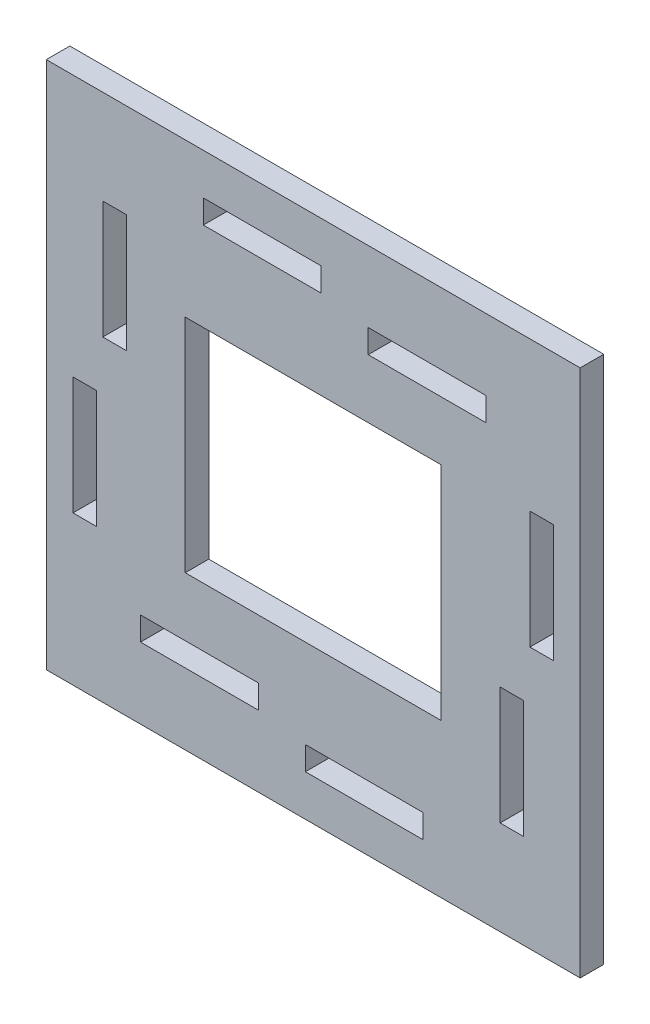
SolidWorks part; units mm, degrees
ref_plane "Alzado" through (0, 0, 0) normal (0, 0, 1) x (1, 0, 0)
ref_plane "Planta" through (0, 0, 0) normal (0, 1, 0) x (1, 0, 0)
ref_plane "Vista lateral" through (0, 0, 0) normal (1, 0, 0) x (0, 0, -1)
sketch "Sketch1" plane through (0, 0, 0) normal (0, 0, 1) x (1, 0, 0)
  line L1 (-34, -33.65) -> (34, -33.65)
  line L2 (-34, -33.65) -> (-34, 33.65)
  line L3 (-34, 33.65) -> (34, 33.65)
  line L4 (34, -33.65) -> (34, 33.65)
  line L5 (-34, -33.65) -> (34, 33.65) construction
  line L6 (-34, 33.65) -> (34, -33.65) construction
  line L7 (-16.3, -14.1) -> (16.3, -14.1)
  line L8 (-16.3, -14.1) -> (-16.3, 14.1)
  line L9 (-16.3, 14.1) -> (16.3, 14.1)
  line L10 (16.3, -14.1) -> (16.3, 14.1)
  line L11 (-16.3, -14.1) -> (16.3, 14.1) construction
  line L12 (-16.3, 14.1) -> (16.3, -14.1) construction
  line L13 (7, 21.6) -> (22, 21.6)
  line L14 (7, 21.6) -> (7, 24.6)
  line L15 (7, 24.6) -> (22, 24.6)
  line L16 (22, 21.6) -> (22, 24.6)
  line L17 (7, 21.6) -> (22, 24.6) construction
  line L18 (7, 24.6) -> (22, 21.6) construction
  line L19 (1, 25.4) -> (-14, 25.4)
  line L20 (1, 25.4) -> (1, 28.4)
  line L21 (1, 28.4) -> (-14, 28.4)
  line L22 (-14, 25.4) -> (-14, 28.4)
  line L23 (1, 25.4) -> (-14, 28.4) construction
  line L24 (1, 28.4) -> (-14, 25.4) construction
  line L25 (27.6, 14.65) -> (30.6, 14.65)
  line L26 (27.6, 14.65) -> (27.6, -0.35)
  line L27 (27.6, -0.35) -> (30.6, -0.35)
  line L28 (30.6, 14.65) -> (30.6, -0.35)
  line L29 (27.6, 14.65) -> (30.6, -0.35) construction
  line L30 (27.6, -0.35) -> (30.6, 14.65) construction
  line L31 (23.8, -6.65) -> (26.8, -6.65)
  line L32 (23.8, -6.65) -> (23.8, -21.65)
  line L33 (23.8, -21.65) -> (26.8, -21.65)
  line L34 (26.8, -6.65) -> (26.8, -21.65)
  line L35 (23.8, -6.65) -> (26.8, -21.65) construction
  line L36 (23.8, -21.65) -> (26.8, -6.65) construction
  line L37 (14, -25.4) -> (-1, -25.4)
  line L38 (14, -25.4) -> (14, -28.4)
  line L39 (14, -28.4) -> (-1, -28.4)
  line L40 (-1, -25.4) -> (-1, -28.4)
  line L41 (14, -25.4) -> (-1, -28.4) construction
  line L42 (14, -28.4) -> (-1, -25.4) construction
  line L43 (-7, -21.6) -> (-22, -21.6)
  line L44 (-7, -21.6) -> (-7, -24.6)
  line L45 (-7, -24.6) -> (-22, -24.6)
  line L46 (-22, -21.6) -> (-22, -24.6)
  line L47 (-7, -21.6) -> (-22, -24.6) construction
  line L48 (-7, -24.6) -> (-22, -21.6) construction
  line L49 (-30.6, 0.35) -> (-27.6, 0.35)
  line L50 (-30.6, 0.35) -> (-30.6, -14.65)
  line L51 (-30.6, -14.65) -> (-27.6, -14.65)
  line L52 (-27.6, 0.35) -> (-27.6, -14.65)
  line L53 (-30.6, 0.35) -> (-27.6, -14.65) construction
  line L54 (-30.6, -14.65) -> (-27.6, 0.35) construction
  line L55 (-23.8, 21.65) -> (-26.8, 21.65)
  line L56 (-23.8, 21.65) -> (-23.8, 6.65)
  line L57 (-23.8, 6.65) -> (-26.8, 6.65)
  line L58 (-26.8, 21.65) -> (-26.8, 6.65)
  line L59 (-23.8, 21.65) -> (-26.8, 6.65) construction
  line L60 (-23.8, 6.65) -> (-26.8, 21.65) construction
  point P0 (0, 0)
  point P6 (0, 0)
  point P11 (14.5, 23.1)
  point P16 (-6.5, 26.9)
  point P21 (29.1, 7.15)
  point P26 (25.3, -14.15)
  point P31 (6.5, -26.9)
  point P36 (-14.5, -23.1)
  point P41 (-29.1, -7.15)
  point P46 (-29.1, -14.65)
  point P47 (-25.3, 14.15)
  dimension "D1" = 68
  dimension "D2" = 67.3
  dimension "D3" = 28.2
  dimension "D4" = 32.6
  dimension "D5" = 7.5
  dimension "D6" = 3
  dimension "D7" = 15
  dimension "D8" = 12
  dimension "D9" = 11.3
  dimension "D10" = 3
  dimension "D11" = 20
  dimension "D12" = 15
  dimension "D13" = 15
  dimension "D14" = 19
  dimension "D15" = 11.3
  dimension "D16" = 3
  dimension "D17" = 15
  dimension "D18" = 3
  dimension "D19" = 12
  dimension "D20" = 7.5
  dimension "D21" = 15
  dimension "D22" = 3
  dimension "D23" = 20
  dimension "D24" = 11.3
  dimension "D25" = 7.5
  dimension "D26" = 3
  dimension "D27" = 15
  dimension "D28" = 12
  dimension "D29" = 3
  dimension "D30" = 15
  dimension "D31" = 11.3
  dimension "D32" = 19
  dimension "D33" = 15
  dimension "D34" = 3
  dimension "D35" = 7.5
  dimension "D36" = 12
extrude "Boss-Extrude1" add sketch "Sketch1" along normal blind 3
